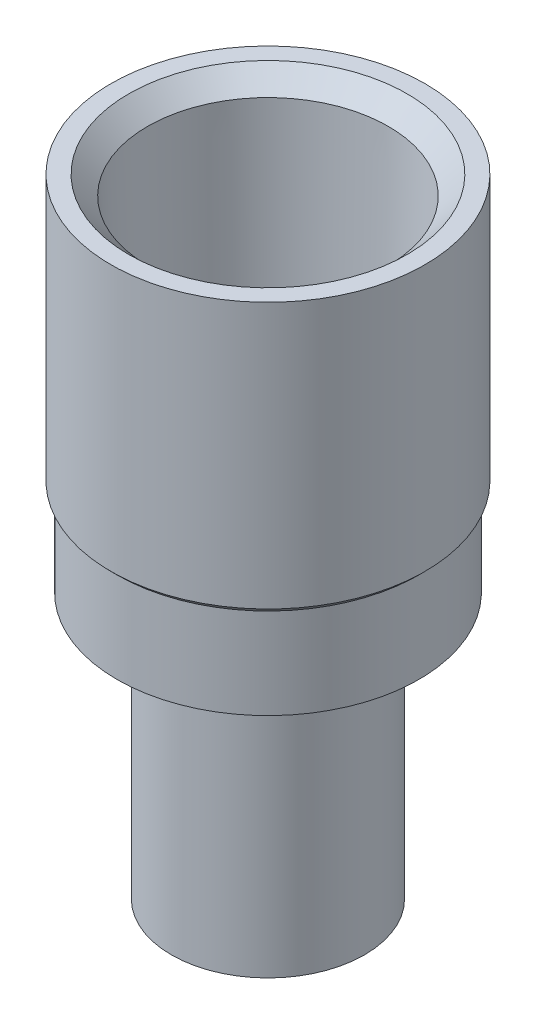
SolidWorks part; units mm, degrees
ref_plane "Přední rovina" through (0, 0, 0) normal (0, 0, 1) x (1, 0, 0)
ref_plane "Horní rovina" through (0, 0, 0) normal (0, 1, 0) x (1, 0, 0)
ref_plane "Pravá rovina" through (0, 0, 0) normal (1, 0, 0) x (0, 0, -1)
sketch "Skica1" plane through (0, 0, 0) normal (0, 1, 0) x (1, 0, 0)
  circle A0 centre (0, 0) radius 13
  dimension "D1" = 26
extrude "Přidat vysunutím1" add sketch "Skica1" along normal blind 52
sketch "Skica2" plane through (0, 0, 0) normal (0, -1, 0) x (1, 0, 0)
  circle A0 centre (0, 0) radius 8
extrude "Odebrat vysunutím1" cut sketch "Skica2" against normal blind 22 flip side to cut
chamfer "Zkosení1" distance 2 angle 45 1 edges at (0, 22, -8)
sketch "Skica3" plane through (0, 22, 0) normal (0, -1, 0) x (1, 0, 0)
  circle A0 centre (0, 0) radius 12.5
extrude "Odebrat vysunutím2" cut sketch "Skica3" against normal blind 8 flip side to cut
chamfer "Zkosení2" distance 0.5 angle 45 1 edges at (0, 30, -12.5)
hole_wizard "1/2 sérii závitu1" positions "Skica5" profile "Skica4" size "1/2" standard "ANSI palce"
sketch "Skica5" plane through (0, 52, 0) normal (0, 1, 0) x (-1, 0, 0)
  circle A0 centre (0, 0) radius 13 construction
  point P0 (0, 0)
  dimension "D1" = 0
sketch "Skica4" plane through (0, 52, 0) normal (1, 0, 0) x (0, 0, 1)
  line L0 (0, 0) -> (0, 25.1546)
  line L1 (8.9281, 20) -> (0, 25.1546)
  line L2 (-8.9281, 20) -> (0, 25.1546) construction
  line L3 (8.9281, 20) -> (8.9281, 16.5)
  line L4 (8.9281, 16.5) -> (9.5264, 16.5)
  line L5 (9.5264, 16.5) -> (9.9738, 1.5578)
  line L6 (9.9738, 1.5578) -> (11.5316, 0)
  line L7 (11.5316, 0) -> (0, 0)
  line L8 (0, -6.35) -> (0, 107.95) construction
  line L9 (-9.9738, 1.5578) -> (-11.5316, 0) construction
  line L11 (-8.9281, 16.5) -> (-9.5264, 16.5) construction
  line L12 (-9.5264, 16.5) -> (-9.9738, 1.5578) construction
  dimension "Průměr závitníku" = 17.8562
  dimension "Hloubka závitníku" = 20
  dimension "Průměr závitu" = 19.9475
  dimension "Úhel závitu" = 3.43
  dimension "Hloubka závitu" = 16.5
  dimension "Průměr kuž. zahloubení" = 23.0632
  dimension "Úhel kuž. zahloubení" = 90
  dimension "Úhel vrtání" = 120
sketch "Skica6" plane through (0, 0, 0) normal (0, -1, 0) x (1, 0, 0)
  circle A0 centre (0, 0) radius 3
extrude "Odebrat vysunutím3" cut sketch "Skica6" against normal through all
